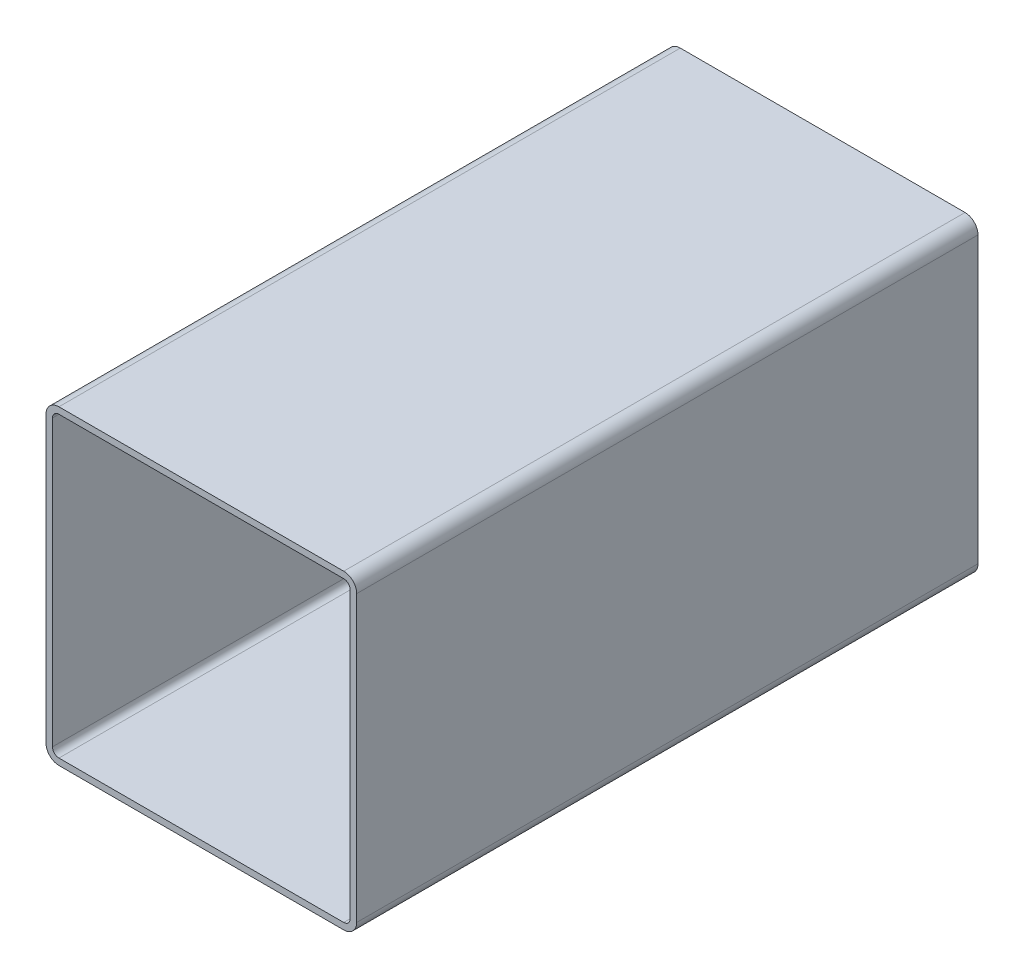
SolidWorks part; units mm, degrees
ref_plane "Front Plane" through (0, 0, 0) normal (0, 0, 1) x (1, 0, 0)
ref_plane "Top Plane" through (0, 0, 0) normal (0, 1, 0) x (1, 0, 0)
ref_plane "Right Plane" through (0, 0, 0) normal (1, 0, 0) x (0, 0, -1)
sketch "Sketch1" plane through (0, 0, 0) normal (0, 0, 1) x (1, 0, 0)
sketch_block_instance "HSS6x6x0.125-1"
sketch_block "HSS6x6x0.125"
extrude "Boss-Extrude1" add sketch "Sketch1" along normal blind 304.8
